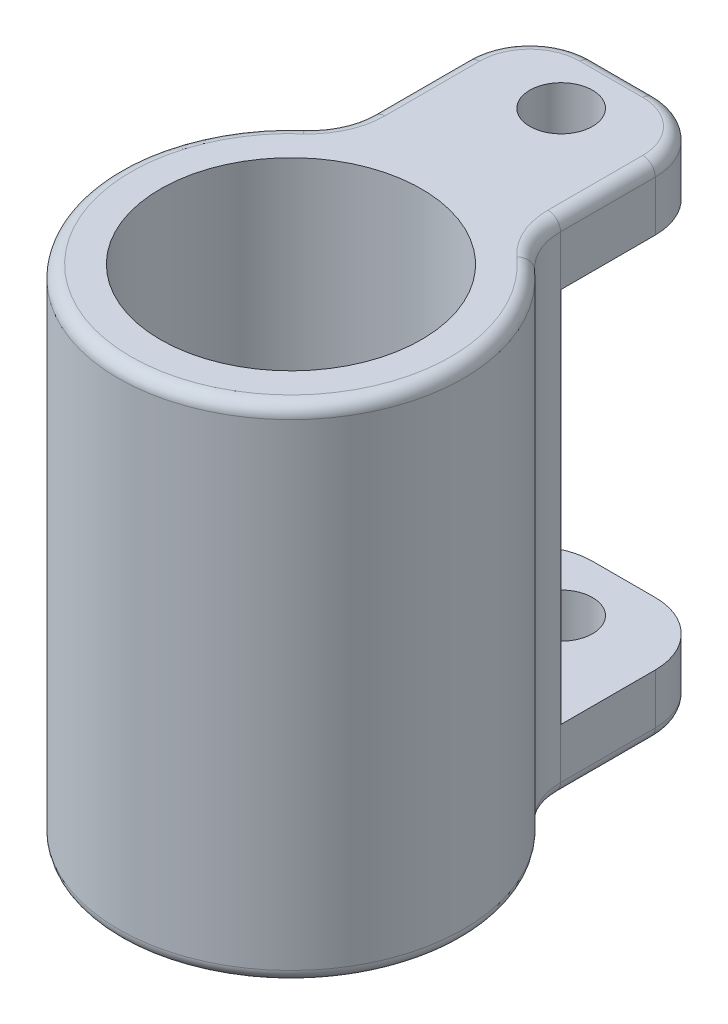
SolidWorks part; units mm, degrees
ref_plane "Front Plane" through (0, 0, 0) normal (0, 0, 1) x (1, 0, 0)
ref_plane "Top Plane" through (0, 0, 0) normal (0, 1, 0) x (1, 0, 0)
ref_plane "Right Plane" through (0, 0, 0) normal (1, 0, 0) x (0, 0, -1)
sketch "Sketch1" plane through (0, 0, 0) normal (0, 1, 0) x (1, 0, 0)
  line L0 (-4.7625, 7.318) -> (-4.7625, 13.668)
  line L1 (4.7625, 7.318) -> (4.7625, 13.668)
  line L2 (1.5875, 16.843) -> (-1.5875, 16.843)
  arc A0 (-4.7625, 7.318) -> (4.7625, 7.318) centre (0, 0) ccw
  circle A1 centre (0, 0) radius 6.604
  arc A2 (4.7625, 13.668) -> (1.5875, 16.843) centre (1.5875, 13.668) ccw
  arc A3 (-1.5875, 16.843) -> (-4.7625, 13.668) centre (-1.5875, 13.668) ccw
  point P5 (0, 16.843)
  point P10 (4.7625, 16.843)
  point P13 (-4.7625, 16.843)
  dimension "D1" = 17.4625
  dimension "D2" = 13.208
  dimension "D5" = 3.175
  dimension "D3" = 9.525
  dimension "D4" = 9.525
extrude "Boss-Extrude1" add sketch "Sketch1" along normal blind 25.4
sketch "Sketch2" plane through (4.7625, 0, 0) normal (1, 0, 0) x (0, 0, -1)
  line L0 (16.843, 25.4) -> (16.843, 0) construction
  line L1 (16.843, 22.225) -> (8.9055, 22.225)
  line L2 (16.843, 22.225) -> (16.843, 3.175)
  line L3 (16.843, 3.175) -> (8.9055, 3.175)
  line L4 (8.9055, 22.225) -> (8.9055, 3.175)
  line L5 (16.843, 25.4) -> (13.668, 25.4) construction
  dimension "D1" = 19.05
  dimension "D2" = 3.175
  dimension "D3" = 7.9375
extrude "Cut-Extrude1" cut sketch "Sketch2" against normal up to next
fillet "Fillet1" radius 3.175 2 edges at (4.7625, 12.7, -7.318) (-4.7625, 12.7, -7.318)
hole_wizard "1/8 (0.125) Diameter Hole1" positions "Sketch4" profile "Sketch3" hole size "1/8" standard "ANSI Inch"
sketch "Sketch4" plane through (0, 25.4, 0) normal (0, 1, 0) x (1, 0, 0)
  line L2 (1.5875, 16.843) -> (-1.5875, 16.843) construction
  line L3 (4.7625, 8.8744) -> (4.7625, 13.668) construction
  point P0 (0, 13.668)
  dimension "D1" = 3.175
  dimension "D2" = 4.7625
sketch "Sketch3" plane through (0, 25.4, -13.668) normal (1, 0, 0) x (0, 0, 1)
  line L0 (0, 0) -> (0, 25.4)
  line L1 (0, 25.4) -> (1.5875, 25.4)
  line L2 (1.5875, 25.4) -> (1.5875, 0)
  line L5 (1.5875, 0) -> (0, 0)
  line L11 (0, -6.35) -> (0, 107.95) construction
  dimension "Thru Hole Dia." = 3.175
  dimension "Thru Hole Depth" = 25.4
fillet "Fillet2" radius 0.635 16 edges at (-5.0391, 0, -7.5782) (-4.7625, 0, -11.2712) (-3.8326, 0, -15.9131) (0, 0, -16.843) (3.8326, 0, -15.9131) (4.7625, 0, -11.2712) (5.0391, 0, -7.5782) (0, 25.4, -16.843) (3.8326, 25.4, -15.9131) (4.7625, 25.4, -11.2712) (5.0391, 25.4, -7.5782) (0, 25.4, 8.7312) (-5.0391, 25.4, -7.5782) (-4.7625, 25.4, -11.2712) (0, 0, 8.7312) (-3.8326, 25.4, -15.9131)
